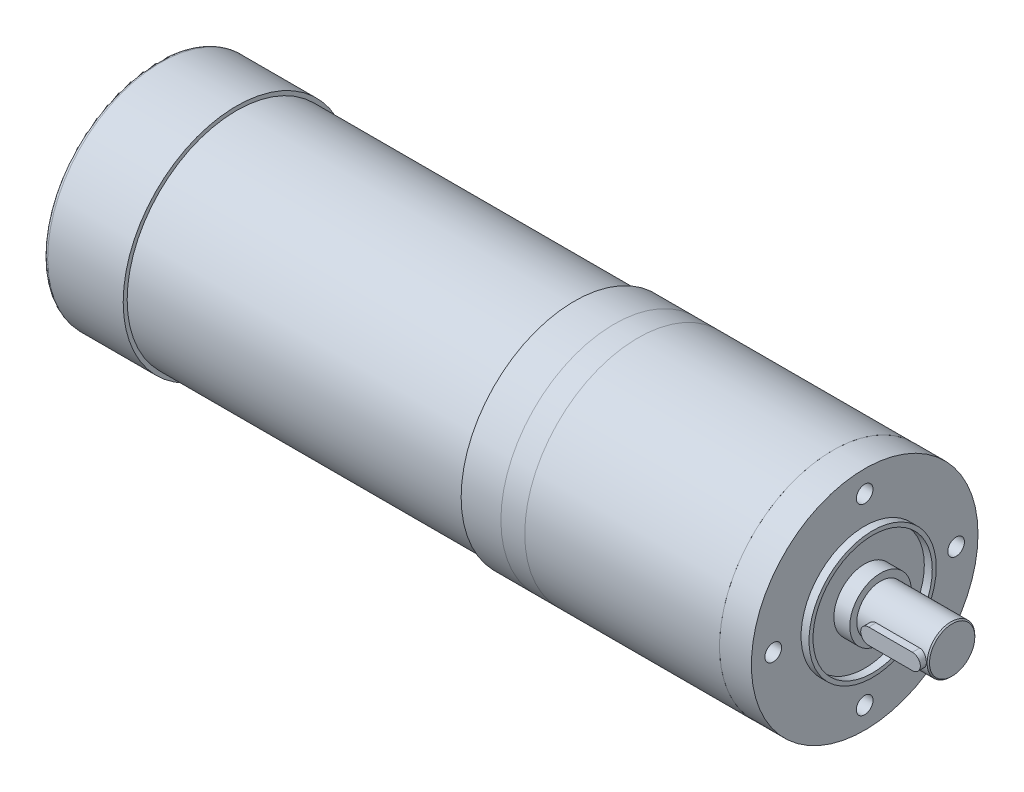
SolidWorks part; units mm, degrees
ref_plane "前视基准面" through (0, 0, 0) normal (0, 0, 1) x (1, 0, 0)
ref_plane "上视基准面" through (0, 0, 0) normal (0, 1, 0) x (1, 0, 0)
ref_plane "右视基准面" through (0, 0, 0) normal (1, 0, 0) x (0, 0, -1)
sketch "草图1" plane through (0, 0, 0) normal (1, 0, 0) x (0, 0, -1)
  circle A0 centre (0, 0) radius 28.5
extrude "凸台-拉伸1" add sketch "草图1" against normal blind 8
sketch "草图2" plane through (-8, 0, 0) normal (-1, 0, 0) x (0, 0, 1)
  circle A0 centre (0, 0) radius 28.5
extrude "凸台-拉伸2" add sketch "草图2" along normal blind 49 separate body
sketch "草图3" plane through (-57, 0, 0) normal (-1, 0, 0) x (0, 0, 1)
  circle A0 centre (0, 0) radius 28.5
extrude "凸台-拉伸3" add sketch "草图3" along normal blind 6 separate body
sketch "草图4" plane through (-63, 0, 0) normal (-1, 0, 0) x (0, 0, 1)
  circle A0 centre (0, 0) radius 28.5
extrude "凸台-拉伸4" add sketch "草图4" along normal blind 10 separate body
sketch "草图5" plane through (-73, 0, 0) normal (-1, 0, 0) x (0, 0, 1)
  circle A0 centre (0, 0) radius 27.5
extrude "凸台-拉伸5" add sketch "草图5" along normal blind 85
sketch "草图6" plane through (-158, 0, 0) normal (-1, 0, 0) x (0, 0, 1)
  circle A0 centre (0, 0) radius 28.5
extrude "凸台-拉伸6" add sketch "草图6" along normal blind 20
fillet "圆角1" radius 1 1 edges at (-178, 0, 28.5)
sketch "草图7" plane through (0, 0, 0) normal (1, 0, 0) x (0, 0, -1)
  circle A0 centre (0, 0) radius 16
  circle A1 centre (0, 0) radius 15
extrude "凸台-拉伸7" add sketch "草图7" along normal blind 2
sketch "草图8" plane through (0, 0, 0) normal (1, 0, 0) x (0, 0, -1)
  circle A0 centre (0, 0) radius 7.75
extrude "凸台-拉伸8" add sketch "草图8" along normal blind 4
sketch "草图9" plane through (4, 0, 0) normal (1, 0, 0) x (0, 0, -1)
  circle A0 centre (0, 0) radius 6
extrude "凸台-拉伸9" add sketch "草图9" along normal blind 18
sketch "草图10" plane through (0, 0, 0) normal (1, 0, 0) x (0, 0, -1)
  point P3 (0, 23)
  point P4 (23, 0)
  point P5 (0, -23)
  point P6 (-23, 0)
hole_wizard "M5 螺纹孔1" positions "3D草图1" profile "草图11" tap size "M5" standard "GB"
sketch3d "3D草图1"
  point P0 (0, 23, 0)
  point P3 (0, 0, -23)
  point P6 (0, -23, 0)
  point P9 (0, 0, 23)
sketch "草图11" plane through (0, 23, 0) normal (0, 1, 0) x (0, 0, -1)
  line L0 (0, 0) -> (0, 15.2618)
  line L1 (0, 15.2618) -> (2.1, 14)
  line L2 (2.1, 14) -> (2.1, 0)
  line L5 (2.1, 0) -> (0, 0)
  line L10 (0, 15.2618) -> (-2.1, 14) construction
  line L11 (0, -6.35) -> (0, 107.95) construction
  dimension "螺纹孔钻头直径" = 4.2
  dimension "螺纹孔钻头深度" = 14
  dimension "导头角度" = 118
ref_plane "基准面1" through (0, 0, 6) normal (0, 0, 1) x (1, 0, 0)
sketch "草图12" plane through (0, 0, 6) normal (0, 0, 1) x (1, 0, 0)
  line L3 (8.5, 2) -> (19.5, 2)
  line L5 (19.5, -2) -> (8.5, -2)
  arc A0 (19.5, -2) -> (19.5, 2) centre (19.5, 0) ccw
  arc A1 (8.5, 2) -> (8.5, -2) centre (8.5, 0) ccw
extrude "切除-拉伸1" cut sketch "草图12" against normal blind 2.5
sketch "草图13" plane through (0, 0, 3.5) normal (0, 0, 1) x (1, 0, 0)
  line L0 (8.5, 2) -> (19.5, 2)
  line L2 (19.5, -2) -> (8.5, -2)
  arc A0 (8.5, 2) -> (8.5, -2) centre (8.5, 0) ccw
  arc A1 (19.5, -2) -> (19.5, 2) centre (19.5, 0) ccw
extrude "凸台-拉伸10" add sketch "草图13" along normal blind 4 separate body
chamfer "倒角1" distance 0.3 angle 45 1 edges at (22, 0, -6)
